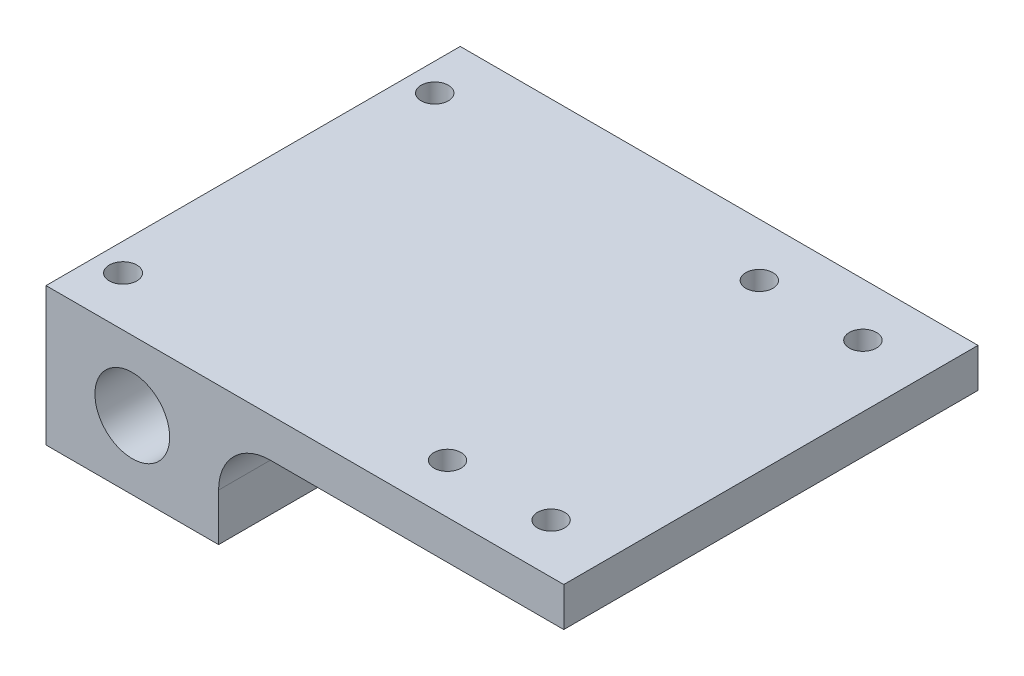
SolidWorks part; units mm, degrees
ref_plane "Front Plane" through (0, 0, 0) normal (0, 0, 1) x (1, 0, 0)
ref_plane "Top Plane" through (0, 0, 0) normal (0, 1, 0) x (1, 0, 0)
ref_plane "Right Plane" through (0, 0, 0) normal (1, 0, 0) x (0, 0, -1)
sketch "Sketch1" plane through (0, 0, 0) normal (0, 0, 1) x (1, 0, 0)
  line L0 (-27.1242, 5.1094) -> (10.9758, 5.1094)
  line L1 (10.9758, 5.1094) -> (10.9758, 2.2372)
  line L2 (10.9758, 2.2372) -> (-10.6142, 2.2372)
  line L3 (-14.4242, -1.5728) -> (-14.4242, -5.0506)
  line L4 (-14.4242, -5.0506) -> (-27.1242, -5.0506)
  line L5 (-27.1242, -5.0506) -> (-27.1242, 5.1094)
  arc A0 (-10.6142, 2.2372) -> (-14.4242, -1.5728) centre (-10.6142, -1.5728) ccw
  dimension "D3" = 3.81
  dimension "D1" = 38.1
  dimension "D2" = 10.16
  dimension "D4" = 25.4
extrude "Boss-Extrude1" add sketch "Sketch1" along normal blind 30.48
sketch "Sketch2" plane through (0, 0, 30.48) normal (0, 0, 1) x (1, 0, 0)
  line L0 (-27.1242, 5.1094) -> (-27.1242, -5.0506) construction
  circle A0 centre (-20.7742, 0) radius 2.75
  dimension "D1" = 5.5
  dimension "D2" = 6.35
extrude "Cut-Extrude2" cut sketch "Sketch2" against normal blind 41.402
sketch "Sketch3" plane through (0, 5.1094, 0) normal (0, 1, 0) x (1, 0, 0)
  line L0 (-27.1242, -30.48) -> (-27.1242, 0) construction
  line L1 (10.9758, -30.48) -> (10.9758, 0) construction
  circle A0 centre (-25.0922, -26.8424) radius 1.016
  circle A1 centre (-25.0922, -3.9091) radius 1
  circle A2 centre (-1.2162, -26.8424) radius 1
  circle A3 centre (-1.2042, -3.9091) radius 1
  circle A4 centre (6.4158, -3.9091) radius 1
  circle A5 centre (6.4038, -26.8424) radius 1
  dimension "D2" = 2
  dimension "D3" = 2.032
  dimension "D4" = 2
  dimension "D5" = 2
  dimension "D6" = 2
  dimension "D7" = 2
  dimension "D1" = 2.032
  dimension "D8" = 7.62
  dimension "D9" = 7.62
  dimension "D10" = 4.572
  dimension "D11" = 2.032
  dimension "D12" = 4.56
extrude "Cut-Extrude3" cut sketch "Sketch3" against normal blind 41.402
